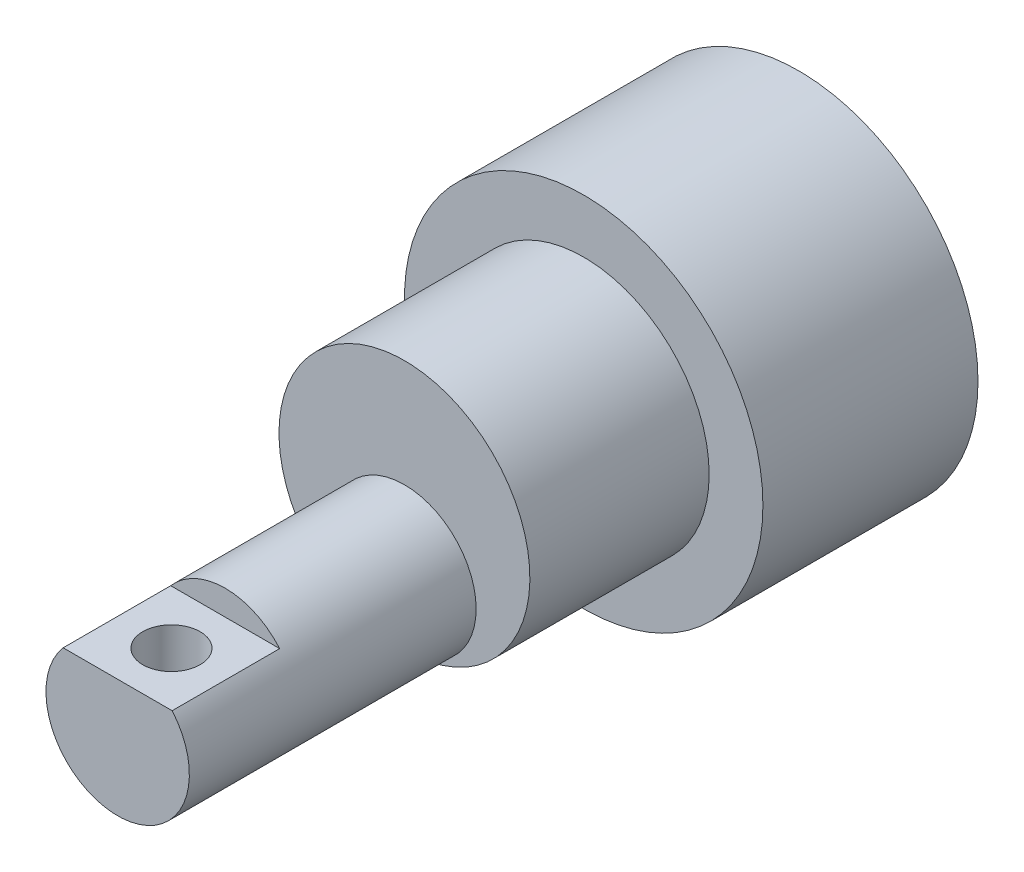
SolidWorks part; units mm, degrees
ref_plane "前视基准面" through (0, 0, 0) normal (0, 0, 1) x (1, 0, 0)
ref_plane "上视基准面" through (0, 0, 0) normal (0, 1, 0) x (1, 0, 0)
ref_plane "右视基准面" through (0, 0, 0) normal (1, 0, 0) x (0, 0, -1)
sketch "草图1" plane through (0, 0, 0) normal (0, 0, 1) x (1, 0, 0)
  circle A0 centre (0, 0) radius 50
  dimension "D1" = 100
extrude "拉伸1" add sketch "草图1" along normal blind 60
sketch "草图2" plane through (0, 0, 60) normal (0, 0, 1) x (1, 0, 0)
  circle A0 centre (0, 0) radius 35
  dimension "D1" = 70
extrude "拉伸2" add sketch "草图2" along normal blind 50
sketch "草图3" plane through (0, 0, 110) normal (0, 0, 1) x (1, 0, 0)
  circle A0 centre (0, -15) radius 20
  circle A1 centre (0, 0) radius 35 construction
  dimension "D1" = 40
extrude "拉伸3" add sketch "草图3" along normal blind 80
ref_plane "基准面1" through (0, 10, 0) normal (0, 1, 0) x (-1, 0, 0)
sketch "草图4" plane through (0, 10, 0) normal (0, 1, 0) x (1, 0, 0)
  line L0 (0, 0) -> (0, -199.8062) construction
  line L1 (-20, -190) -> (-20, -160)
  line L2 (-20, -190) -> (20, -190) construction
  line L3 (-20, -160) -> (20, -160)
  line L4 (20, -160) -> (20, -190)
  line L5 (20, -190) -> (-20, -190)
  dimension "D1" = 40
  dimension "D2" = 30
extrude "切除-拉伸1" cut sketch "草图4" against normal blind 12
sketch "草图5" plane through (0, -2, 0) normal (0, 1, 0) x (1, 0, 0)
  line L0 (0, -190) -> (0, -135.3206) construction
  line L1 (-15.1987, -190) -> (15.1987, -190) construction
  line L2 (15.1987, -175) -> (-15.1987, -175) construction
  line L3 (15.1987, -160) -> (15.1987, -190) construction
  line L4 (-15.1987, -190) -> (-15.1987, -160) construction
  circle A0 centre (0, -175) radius 8
  dimension "D1" = 16
extrude "切除-拉伸2" cut sketch "草图5" against normal through all
